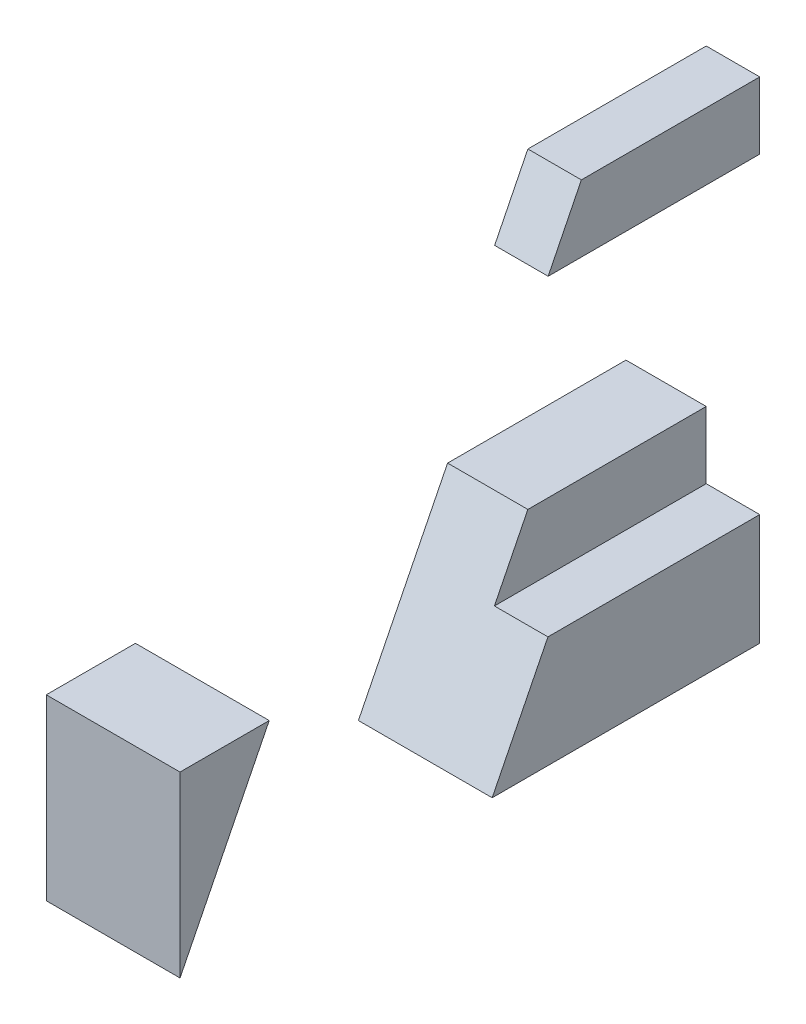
SolidWorks part; units mm, degrees
ref_plane "前视基准面" through (0, 0, 0) normal (0, 0, 1) x (1, 0, 0)
ref_plane "上视基准面" through (0, 0, 0) normal (0, 1, 0) x (1, 0, 0)
ref_plane "右视基准面" through (0, 0, 0) normal (1, 0, 0) x (0, 0, -1)
sketch "草图1" plane through (0, 0, 0) normal (0, 1, 0) x (1, 0, 0)
  line L1 (-15, -30) -> (15, -30)
  line L2 (-15, -30) -> (-15, 30)
  line L3 (-15, 30) -> (15, 30)
  line L4 (15, -30) -> (15, 30)
  line L5 (-15, -30) -> (15, 30) construction
  line L6 (-15, 30) -> (15, -30) construction
  point P0 (0, 0)
  dimension "D1" = 30
  dimension "D2" = 60
extrude "凸台-拉伸1" add sketch "草图1" along normal blind 40
ref_plane "基准面1" through (0, 0, 100) normal (0, 0, 1) x (1, 0, 0)
ref_plane "基准面2" through (0, 110, 0) normal (0, 1, 0) x (-1, 0, 0)
sketch "草图4" plane through (0, 0, 0) normal (1, 0, 0) x (0, 0, -1)
  line L0 (-100, 40) -> (-80, 40)
  line L1 (-100, 16.5) -> (-100, -16.5) construction
  line L2 (-80, 40) -> (-100, 0)
  line L3 (-100, 0) -> (-100, 40)
  dimension "D1" = 20
extrude "凸台-拉伸2" add sketch "草图4" along normal mid plane 30 separate body
sketch "草图6" plane through (0, 0, 0) normal (1, 0, 0) x (0, 0, -1)
  line L0 (-30, 40) -> (-10, 40)
  line L1 (-30, 40) -> (30, 40) construction
  line L2 (-10, 40) -> (-30, 0)
  line L3 (-30, 0) -> (-30, 40)
  dimension "D1" = 20
extrude "切除-拉伸1" cut sketch "草图6" against normal blind 30 from vertex at 15
sketch "草图7" plane through (0, 0, 0) normal (1, 0, 0) x (0, 0, -1)
  line L0 (30, 110) -> (30, 69.7226)
  line L1 (16.5, 110) -> (-16.5, 110) construction
  line L2 (30, 69.7226) -> (-30, 69.7226)
  line L4 (-10, 110) -> (30, 110)
  line L5 (-10, 110) -> (-30, 69.7226)
  dimension "D1" = 60
  dimension "D2" = 40
extrude "凸台-拉伸3" add sketch "草图7" along normal mid plane 30 separate body
sketch "草图8" plane through (0, 0, -30) normal (0, 0, -1) x (-1, 0, 0)
  line L0 (-15, 110) -> (-3, 110)
  line L1 (16.5, 110) -> (-16.5, 110) construction
  line L2 (-15, 69.7226) -> (-15, 110) construction
  line L3 (-3, 110) -> (-3, 95)
  line L4 (-3, 95) -> (-15, 95)
  line L5 (-15, 95) -> (-15, 110)
  dimension "D1" = 12
  dimension "D2" = 15
extrude "切除-拉伸2" cut sketch "草图8" against normal up to next flip side to cut
sketch "草图9" plane through (0, 0, -30) normal (0, 0, -1) x (-1, 0, 0)
  line L0 (-15, 40) -> (-3, 40)
  line L1 (-15, 40) -> (15, 40) construction
  line L2 (-3, 40) -> (-3, 25)
  line L3 (-3, 25) -> (-15, 25)
  line L4 (-15, 40) -> (-15, 0) construction
  line L5 (-15, 25) -> (-15, 40)
  dimension "D1" = 12
  dimension "D2" = 15
extrude "切除-拉伸3" cut sketch "草图9" against normal blind 50
